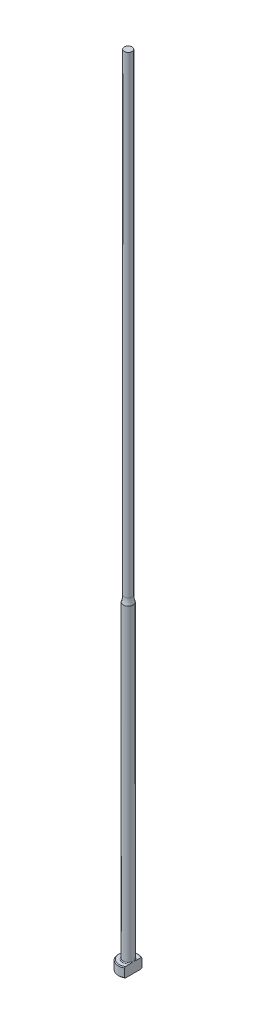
SolidWorks part; units mm, degrees
ref_plane "Front Plane" through (0, 0, 0) normal (0, 0, 1) x (1, 0, 0)
ref_plane "Top Plane" through (0, 0, 0) normal (0, 1, 0) x (1, 0, 0)
ref_plane "Right Plane" through (0, 0, 0) normal (1, 0, 0) x (0, 0, -1)
sketch "Sketch1" plane through (0, 0, 0) normal (0, 0, 1) x (1, 0, 0)
  line L0 (0, 259.9588) -> (0, -15.1925) construction
  line L1 (0, 0) -> (-3.175, 0)
  line L2 (-3.175, 0) -> (-3.175, 3.175)
  line L3 (-3.175, 3.175) -> (-1.5875, 3.175)
  line L4 (-1.2535, 103.6323) -> (-1.2535, 254)
  line L5 (-1.2535, 254) -> (0, 254)
  line L6 (0, 254) -> (0, 0)
  line L7 (-1.5875, 3.175) -> (-1.5875, 101.6)
  arc A0 (-1.5875, 101.6) -> (-1.2535, 103.6323) centre (-7.6035, 103.6323) ccw
  point P13 (-1.5875, 0)
  dimension "D1" = 6.35
  dimension "L" = 254
  dimension "D2" = 3.175
  dimension "H" = 6.35
  dimension "T" = 3.175
  dimension "D" = 2.507
  dimension "S" = 101.6
revolve "Revolve1" add sketch "Sketch1" angle 360 about L0
chamfer "Chamfer1" distance 0.254 angle 45 2 edges at (0, 3.175, 3.175) (0, 0, 3.175)
fillet "Fillet1" radius 0.254 1 edges at (0, 3.175, 1.5875)
sketch "Sketch2" plane through (0, 0, 0) normal (0, 1, 0) x (1, 0, 0)
  line L0 (1.5875, -2.7496) -> (1.5875, 2.7496)
  circle A0 centre (0, 0) radius 3.175 construction
  arc A2 (1.5875, -2.7496) -> (1.5875, 2.7496) centre (0, 0) ccw
  circle A3 centre (0, 0) radius 3.175 construction
  circle A4 centre (0, 0) radius 1.5875 construction
extrude "Key Head" cut sketch "Sketch2" along normal up to next
